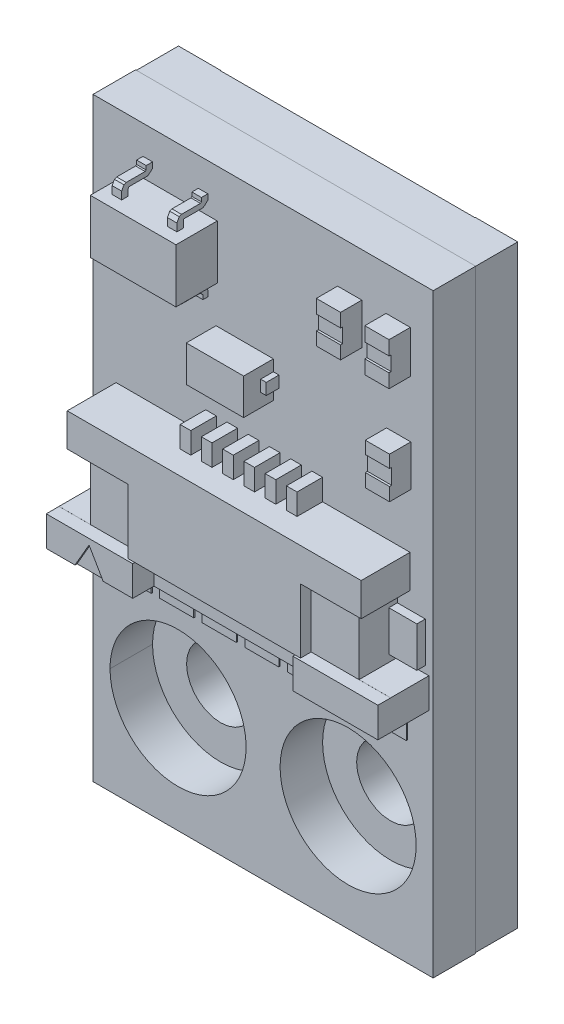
SolidWorks part; units mm, degrees
ref_plane "Front Plane" through (0, 0, 0) normal (0, 0, 1) x (1, 0, 0)
ref_plane "Top Plane" through (0, 0, 0) normal (0, 1, 0) x (1, 0, 0)
ref_plane "Right Plane" through (0, 0, 0) normal (1, 0, 0) x (0, 0, -1)
imported_body "Imported1"
sketch "Sketch1" plane through (0, 0, 0) normal (0, 0, -1) x (-1, 0, 0)
  line L8 (-250.01, 258.99) -> (-257.99, 258.99)
  line L9 (-257.99, 258.99) -> (-257.99, 245.01)
  line L10 (-257.99, 245.01) -> (-250.01, 245.01)
  line L11 (-250.01, 245.01) -> (-250.01, 258.99)
  line L12 (-250.01, 258.99) -> (-257.99, 258.99)
  line L13 (-257.99, 258.99) -> (-257.99, 245.01)
  line L14 (-257.99, 245.01) -> (-250.01, 245.01)
  line L15 (-250.01, 245.01) -> (-250.01, 258.99)
  circle A0 centre (-252, 247.5) radius 0.8
  circle A1 centre (-256, 247.5) radius 0.8
  dimension "D2" = 1.6
  dimension "D1" = 0.01
extrude "Boss-Extrude1" add sketch "Sketch1" along normal blind 1
sketch "Sketch2" plane through (0, 0, -1) normal (0, 0, -1) x (-1, 0, 0)
  line L0 (-250.01, 245.01) -> (-250.01, 258.99) construction
  line L1 (-251.01, 259.4815) -> (-256.99, 259.4815)
  line L2 (-251.01, 259.4815) -> (-251.01, 250.99)
  line L3 (-252.01, 249.99) -> (-255.99, 249.99)
  line L4 (-256.99, 259.4815) -> (-256.99, 250.99)
  line L5 (-257.99, 258.99) -> (-257.99, 245.01) construction
  line L6 (-250.01, 258.99) -> (-257.99, 258.99) construction
  arc A0 (-255.99, 249.99) -> (-256.99, 250.99) centre (-255.99, 250.99) cw
  arc A1 (-251.01, 250.99) -> (-252.01, 249.99) centre (-252.01, 250.99) cw
  dimension "D4" = 1
  dimension "D1" = 1
  dimension "D2" = 1
  dimension "D3" = 9
extrude "Cut-Extrude1" cut sketch "Sketch2" against normal blind 0.01
sketch "Sketch3" plane through (0, 0, 1) normal (0, 0, 1) x (1, 0, 0)
  line L0 (258, 245) -> (258, 259) construction
  line L1 (257.399, 249.55) -> (256.599, 249.55)
  line L2 (257.399, 249.55) -> (257.399, 250.65)
  line L3 (257.399, 250.65) -> (256.599, 250.65)
  line L4 (256.599, 249.55) -> (256.599, 250.65)
  line L8 (256.399, 249.55) -> (255.599, 249.55)
  line L9 (256.399, 249.55) -> (256.399, 250.65)
  line L10 (256.399, 250.65) -> (255.599, 250.65)
  line L11 (255.599, 249.55) -> (255.599, 250.65)
  line L12 (255.399, 249.55) -> (254.599, 249.55)
  line L13 (255.399, 249.55) -> (255.399, 250.65)
  line L14 (255.399, 250.65) -> (254.599, 250.65)
  line L15 (254.599, 249.55) -> (254.599, 250.65)
  line L16 (254.399, 249.55) -> (253.599, 249.55)
  line L17 (254.399, 249.55) -> (254.399, 250.65)
  line L18 (254.399, 250.65) -> (253.599, 250.65)
  line L19 (253.599, 249.55) -> (253.599, 250.65)
  line L20 (253.399, 249.55) -> (252.599, 249.55)
  line L21 (253.399, 249.55) -> (253.399, 250.65)
  line L22 (253.399, 250.65) -> (252.599, 250.65)
  line L23 (252.599, 249.55) -> (252.599, 250.65)
  line L24 (252.399, 249.55) -> (251.599, 249.55)
  line L25 (252.399, 249.55) -> (252.399, 250.65)
  line L26 (252.399, 250.65) -> (251.599, 250.65)
  line L27 (251.599, 249.55) -> (251.599, 250.65)
  line L28 (251.399, 249.55) -> (250.599, 249.55)
  line L29 (251.399, 249.55) -> (251.399, 250.65)
  line L30 (251.399, 250.65) -> (250.599, 250.65)
  line L31 (250.599, 249.55) -> (250.599, 250.65)
  circle A0 centre (256, 247.5) radius 0.8 construction
  dimension "D3" = 2.05
  dimension "D1" = 0.8
  dimension "D2" = 1.1
  dimension "D4" = 0.601
  dimension "D6" = 1
  dimension "D5" = 7
extrude "Boss-Extrude3" add sketch "Sketch3" along normal blind 0.03
sketch "Sketch4" plane through (0, 0, 1) normal (0, 0, 1) x (1, 0, 0)
  line L0 (250, 245) -> (258, 245) construction
  line L1 (257.9, 250.4) -> (250.1, 250.4)
  line L2 (257.9, 250.4) -> (257.9, 251.107)
  line L3 (257.4571, 253.4) -> (250.5429, 253.4)
  line L4 (250.1, 250.4) -> (250.1, 251.107)
  line L5 (258, 245) -> (258, 259) construction
  line L6 (250, 259) -> (250, 245) construction
  line L7 (254, 245) -> (254, 248.0601) construction
  line L8 (257.9, 251.107) -> (257.1577, 251.107)
  line L9 (257.4571, 252.6216) -> (257.1577, 252.6216)
  line L10 (257.4571, 252.6216) -> (257.4571, 253.4)
  line L11 (257.1577, 251.107) -> (257.1577, 252.6216)
  line L12 (250.8423, 251.107) -> (250.8423, 252.6216)
  line L13 (250.5429, 252.6216) -> (250.8423, 252.6216)
  line L14 (250.5429, 252.6216) -> (250.5429, 253.4)
  line L15 (250.1, 251.107) -> (250.8423, 251.107)
  dimension "D1" = 5.4
  dimension "D3" = 0.1
  dimension "D4" = 0.1
extrude "Boss-Extrude4" add sketch "Sketch4" along normal blind 1.2
sketch "Sketch5" plane through (0, 0, 1) normal (0, 0, 1) x (1, 0, 0)
  line L0 (257.4571, 253.4) -> (250.5429, 253.4) construction
  line L1 (255.399, 253.1944) -> (255.149, 253.1944)
  line L2 (255.399, 253.1944) -> (255.399, 253.9)
  line L3 (255.399, 253.9) -> (255.149, 253.9)
  line L4 (255.149, 253.1944) -> (255.149, 253.9)
  line L5 (255.399, 249.55) -> (255.399, 250.4) construction
  line L6 (254.899, 253.1944) -> (254.649, 253.1944)
  line L7 (254.899, 253.1944) -> (254.899, 253.9)
  line L8 (254.899, 253.9) -> (254.649, 253.9)
  line L9 (254.649, 253.1944) -> (254.649, 253.9)
  line L10 (254.399, 253.1944) -> (254.149, 253.1944)
  line L11 (254.399, 253.1944) -> (254.399, 253.9)
  line L12 (254.399, 253.9) -> (254.149, 253.9)
  line L13 (254.149, 253.1944) -> (254.149, 253.9)
  line L14 (253.899, 253.1944) -> (253.649, 253.1944)
  line L15 (253.899, 253.1944) -> (253.899, 253.9)
  line L16 (253.899, 253.9) -> (253.649, 253.9)
  line L17 (253.649, 253.1944) -> (253.649, 253.9)
  line L18 (253.399, 253.1944) -> (253.149, 253.1944)
  line L19 (253.399, 253.1944) -> (253.399, 253.9)
  line L20 (253.399, 253.9) -> (253.149, 253.9)
  line L21 (253.149, 253.1944) -> (253.149, 253.9)
  line L22 (252.899, 253.1944) -> (252.649, 253.1944)
  line L23 (252.899, 253.1944) -> (252.899, 253.9)
  line L24 (252.899, 253.9) -> (252.649, 253.9)
  line L25 (252.649, 253.1944) -> (252.649, 253.9)
  dimension "D1" = 0.25
  dimension "D2" = 0.5
  dimension "D3" = 6
extrude "Boss-Extrude5" add sketch "Sketch5" along normal blind 0.6
sketch "Sketch6" plane through (0, 0, 2.2) normal (0, 0, 1) x (1, 0, 0)
  line L0 (254, 245) -> (254, 248.2186) construction
  line L1 (258.1264, 251.106) -> (256.0305, 251.106)
  line L2 (258.1264, 251.106) -> (258.1264, 252.6191)
  line L3 (258.1264, 252.6191) -> (256.0305, 252.6191)
  line L4 (256.0305, 251.106) -> (256.0305, 252.6191)
  line L5 (250, 245) -> (258, 245) construction
  line L6 (251.9694, 251.106) -> (251.9694, 252.6191)
  line L7 (249.8736, 252.6191) -> (251.9694, 252.6191)
  line L8 (249.8736, 251.106) -> (249.8736, 252.6191)
  line L9 (249.8736, 251.106) -> (251.9694, 251.106)
extrude "Cut-Extrude2" cut sketch "Sketch6" against normal blind 0.3
sketch "Sketch7" plane through (0, 0, 2.2) normal (0, 0, 1) x (1, 0, 0)
  line L0 (256.0305, 251.106) -> (257.9, 251.106) construction
  line L1 (257.5989, 251.106) -> (250.3243, 251.106)
  line L2 (257.5989, 251.106) -> (257.5989, 254.4079)
  line L3 (257.5989, 254.4079) -> (250.3243, 254.4079)
  line L4 (250.3243, 251.106) -> (250.3243, 254.4079)
  line L5 (251.399, 250.4) -> (250.599, 250.4) construction
  line L6 (251.1066, 250.9744) -> (251.4383, 250.4)
  line L7 (251.4383, 250.4) -> (250.775, 250.4)
  line L8 (250.775, 250.4) -> (251.1066, 250.9744)
  circle A0 centre (251.1066, 250.5915) radius 0.1915 construction
extrude "Cut-Extrude3" cut sketch "Sketch7" against normal blind 0.05
sketch "Sketch8" plane through (0, 0, 1) normal (0, 0, 1) x (1, 0, 0)
  line L1 (252.4768, 256.6447) -> (252.0503, 256.6447)
  line L2 (251.8253, 256.6447) -> (251.4003, 256.6447)
  line L3 (251.1761, 256.6447) -> (250.9353, 256.6447)
  line L4 (251.1761, 257.912) -> (250.9353, 257.912)
  line L5 (252.4768, 257.912) -> (251.4003, 257.912)
  line L23 (252.9511, 256.6447) -> (252.7003, 256.6447)
  line L28 (252.9511, 256.6447) -> (252.9511, 257.912)
  line L29 (252.9511, 257.912) -> (252.7003, 257.912)
  line L30 (250.9353, 256.6447) -> (250.9353, 257.912)
  line L31 (252.7003, 256.2251) -> (252.4768, 256.2251)
  line L32 (252.7003, 256.2251) -> (252.7003, 256.6447)
  line L34 (252.4768, 256.2251) -> (252.4768, 256.6447)
  line L35 (252.0503, 256.2251) -> (251.8253, 256.2251)
  line L36 (252.0503, 256.2251) -> (252.0503, 256.6447)
  line L38 (251.8253, 256.2251) -> (251.8253, 256.6447)
  line L39 (251.4003, 256.2251) -> (251.1761, 256.2251)
  line L40 (251.4003, 256.2251) -> (251.4003, 256.6447)
  line L42 (251.1761, 256.2251) -> (251.1761, 256.6447)
  line L43 (252.7003, 258.3251) -> (252.4768, 258.3251)
  line L44 (252.7003, 258.3251) -> (252.7003, 257.912)
  line L46 (252.4768, 258.3251) -> (252.4768, 257.912)
  line L47 (251.4003, 258.3251) -> (251.1761, 258.3251)
  line L48 (251.4003, 258.3251) -> (251.4003, 257.912)
  line L50 (251.1761, 258.3251) -> (251.1761, 257.912)
extrude "Boss-Extrude6" add sketch "Sketch8" along normal blind 1 separate body
sketch "Sketch9" plane through (250.9353, 0, 0) normal (-1, 0, 0) x (0, 0, 1)
  line L0 (2.3085, 256.6447) -> (1.727, 256.6447)
  line L1 (1.727, 256.6447) -> (1.727, 256.5279)
  line L2 (1.727, 256.5279) -> (1.6637, 256.4102)
  line L3 (1.6125, 256.389) -> (1.1735, 256.389)
  line L5 (1.1735, 256.389) -> (1.1144, 256.323)
  line L6 (1.1144, 256.323) -> (1.1144, 255.9769)
  line L7 (1.1144, 255.9769) -> (2.3085, 255.9769)
  line L8 (2.3085, 255.9769) -> (2.3085, 256.6447)
  line L11 (1.5753, 256.5477) -> (1.543, 256.5145)
  line L12 (2, 257.912) -> (1, 257.912) construction
  line L13 (1.543, 256.5145) -> (1.2704, 256.5145)
  line L14 (1.2704, 256.5145) -> (1.1513, 256.5145)
  line L15 (1.1513, 256.5145) -> (1.046, 256.4695)
  line L16 (1, 259) -> (1, 245) construction
  line L17 (1.046, 256.4695) -> (1, 256.3662)
  line L18 (1, 258.1942) -> (1, 256.3662)
  line L19 (2, 256.6447) -> (1, 256.6447) construction
  line L20 (1.0289, 256.6447) -> (1.5753, 256.6447)
  line L21 (1.5753, 256.6447) -> (1.5753, 256.5477)
  line L22 (1.5753, 257.912) -> (1.5753, 258.0553)
  line L23 (1.0289, 257.912) -> (1.5753, 257.912)
  line L25 (1.0622, 258.1338) -> (1, 258.1942)
  line L26 (1.1157, 258.0963) -> (1.0622, 258.1338)
  line L27 (1.2698, 258.0963) -> (1.1157, 258.0963)
  line L28 (1.5661, 258.0963) -> (1.2698, 258.0963)
  line L29 (1.5753, 258.0553) -> (1.5661, 258.0963)
  line L30 (2.298, 259.6644) -> (2.0455, 257.912)
  line L31 (1.1506, 259.6644) -> (2.298, 259.6644)
  line L32 (1.1506, 258.2344) -> (1.1506, 259.6644)
  line L33 (1.1735, 258.2161) -> (1.1506, 258.2344)
  line L34 (1.6196, 258.2161) -> (1.1735, 258.2161)
  line L35 (1.727, 258.0927) -> (1.6724, 258.1942)
  line L36 (1.727, 257.912) -> (1.727, 258.0927)
  line L37 (2.0455, 257.912) -> (1.727, 257.912)
  line L38 (1.6125, 256.389) -> (1.6637, 256.4102)
  line L39 (1.6724, 258.1942) -> (1.6196, 258.2161)
  line L42 (1.0289, 256.6447) -> (1.0289, 257.912)
extrude "Cut-Extrude4" cut sketch "Sketch9" against normal blind 4
sketch "Sketch10" plane through (0, 0, 1) normal (0, 0, 1) x (1, 0, 0)
  line L0 (257.4624, 257.9842) -> (256.8924, 257.9842)
  line L13 (257.4624, 257.9842) -> (257.4624, 256.9842)
  line L14 (257.4624, 256.9842) -> (256.8924, 256.9842)
  line L15 (256.8924, 257.9842) -> (256.8924, 256.9842)
  line L16 (256.3226, 257.9704) -> (255.7526, 257.9704)
  line L17 (256.3226, 257.9704) -> (256.3226, 257.0004)
  line L18 (256.3226, 257.0004) -> (255.7526, 257.0004)
  line L19 (255.7526, 257.9704) -> (255.7526, 257.0004)
  line L20 (257.4739, 255.6576) -> (256.9039, 255.6576)
  line L21 (257.4739, 255.6576) -> (257.4739, 254.6876)
  line L22 (257.4739, 254.6876) -> (256.9039, 254.6876)
  line L23 (256.9039, 255.6576) -> (256.9039, 254.6876)
extrude "Boss-Extrude7" add sketch "Sketch10" along normal blind 0.5
sketch "Sketch11" plane through (0, 0, 1) normal (0, 0, 1) x (1, 0, 0)
  line L5 (254.2425, 255.7338) -> (252.8936, 255.7338)
  line L6 (254.2425, 255.7338) -> (254.2425, 254.8859)
  line L7 (254.2425, 254.8859) -> (252.8936, 254.8859)
  line L8 (252.8936, 255.7338) -> (252.8936, 254.8859)
extrude "Boss-Extrude8" add sketch "Sketch11" along normal blind 0.7
sketch "Sketch12" plane through (0, 0, 1) normal (0, 0, 1) x (1, 0, 0)
  line L1 (254.3745, 255.2006) -> (254.1415, 255.2006)
  line L2 (254.3745, 255.2006) -> (254.3745, 255.4699)
  line L3 (254.3745, 255.4699) -> (254.1415, 255.4699)
  line L4 (254.1415, 255.2006) -> (254.1415, 255.4699)
  line L5 (253.0059, 255.2006) -> (252.7584, 255.2006)
  line L6 (253.0059, 255.2006) -> (253.0059, 255.4699)
  line L7 (253.0059, 255.4699) -> (252.7584, 255.4699)
  line L8 (252.7584, 255.2006) -> (252.7584, 255.4699)
extrude "Boss-Extrude9" add sketch "Sketch12" along normal blind 0.3
sketch "Sketch13" plane through (0, 0, 1.5) normal (0, 0, 1) x (1, 0, 0)
  line L1 (258.3476, 257.308) -> (255.097, 257.308)
  line L2 (258.3476, 257.308) -> (258.3476, 257.6519)
  line L3 (258.3476, 257.6519) -> (255.097, 257.6519)
  line L4 (255.097, 257.308) -> (255.097, 257.6519)
  line L5 (258.3334, 254.9984) -> (256.5163, 254.9984)
  line L6 (258.3334, 254.9984) -> (258.3334, 255.3651)
  line L7 (258.3334, 255.3651) -> (256.5163, 255.3651)
  line L8 (256.5163, 254.9984) -> (256.5163, 255.3651)
extrude "Cut-Extrude5" cut sketch "Sketch13" against normal blind 0.05
sketch "Sketch14" plane through (0, 0, 2.2) normal (0, 0, 1) x (1, 0, 0)
  line L0 (250.1, 251.106) -> (257.9, 251.106) construction
  line L1 (255.8993, 250.0933) -> (252.1343, 250.0933)
  line L2 (255.8993, 250.0933) -> (255.8993, 251.106)
  line L3 (255.8993, 251.106) -> (252.1343, 251.106)
  line L4 (252.1343, 250.0933) -> (252.1343, 251.106)
extrude "Cut-Extrude6" cut sketch "Sketch14" against normal blind 0.5
sketch "Sketch15" plane through (0, 251.106, 0) normal (0, -1, 0) x (1, 0, 0)
  line L0 (255.8993, 2.2) -> (255.8993, 1.7) construction
  line L1 (252.1343, 1.7) -> (255.8993, 1.7)
  line L2 (252.1343, 1.7) -> (252.1343, 1.95)
  line L3 (252.1343, 1.95) -> (255.8993, 1.95)
  line L4 (255.8993, 1.7) -> (255.8993, 1.95)
extrude "Cut-Extrude7" cut sketch "Sketch15" against normal blind 0.5
sketch "Sketch16" plane through (0, 0, 1) normal (0, 0, 1) x (1, 0, 0)
  line L0 (254, 245) -> (254, 247.9854) construction
  line L1 (250.1839, 252.2214) -> (251.0092, 252.2214)
  line L2 (250.1839, 252.2214) -> (250.1839, 251.2731)
  line L3 (250.1839, 251.2731) -> (251.0092, 251.2731)
  line L4 (251.0092, 252.2214) -> (251.0092, 251.2731)
  line L5 (250, 245) -> (258, 245) construction
  line L6 (256.9908, 252.2214) -> (256.9908, 251.2731)
  line L7 (257.8161, 251.2731) -> (256.9908, 251.2731)
  line L8 (257.8161, 252.2214) -> (257.8161, 251.2731)
  line L9 (257.8161, 252.2214) -> (256.9908, 252.2214)
extrude "Boss-Extrude10" add sketch "Sketch16" along normal blind 0.2
sketch "Sketch17" plane through (0, 0, 1) normal (0, 0, 1) x (1, 0, 0)
  line L1 (250.3929, 258.8068) -> (257.5572, 258.8068)
  line L2 (250.3929, 258.8068) -> (250.3929, 251.4598)
  line L3 (250.3929, 251.4598) -> (257.5572, 251.4598)
  line L4 (257.5572, 258.8068) -> (257.5572, 251.4598)
extrude "Boss-Extrude11" add sketch "Sketch17" against normal blind 1
